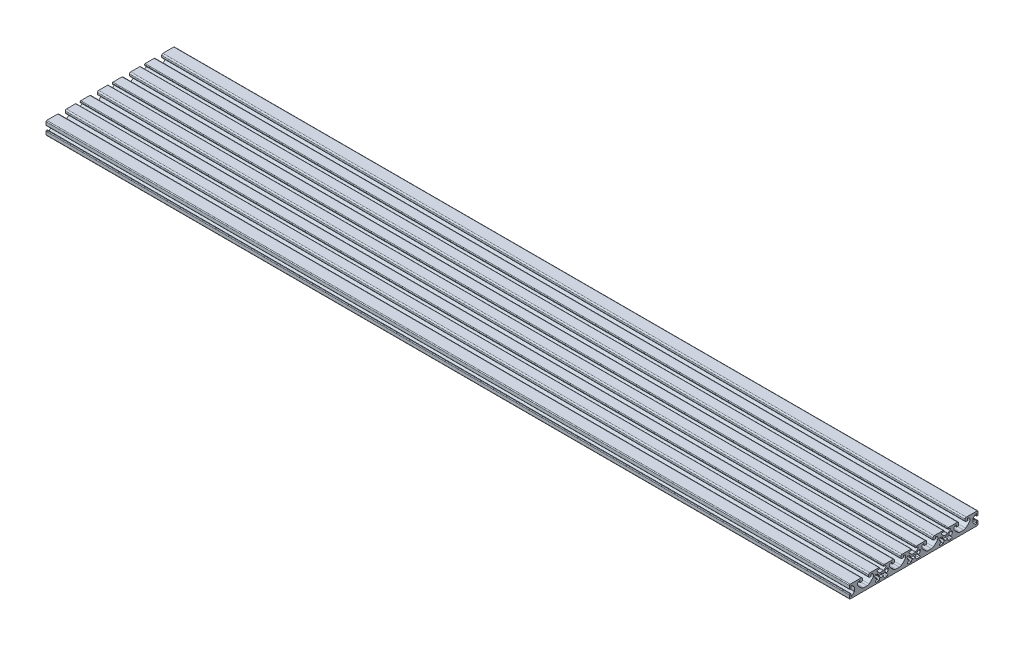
SolidWorks part; units mm, degrees
ref_plane "Ebene vorne" through (0, 0, 0) normal (0, 0, 1) x (1, 0, 0)
ref_plane "Ebene oben" through (0, 0, 0) normal (0, 1, 0) x (1, 0, 0)
ref_plane "Ebene rechts" through (0, 0, 0) normal (1, 0, 0) x (0, 0, -1)
sketch "Skizze1" plane through (0, 0, 0) normal (0, 1, 0) x (1, 0, 0)
  line L0 (0, 0) -> (1000, 0)
  dimension "D1" = 1000
other "Strukturbauteil1"
ref_plane "Ebene1" through (0, 0, 0) normal (1, 0, 0) x (0, 0, -1)
sketch "Model" plane through (0, 0, 0) normal (1, 0, 0) x (0, 0, -1)
  line L0 (-48.4749, 1.0607) -> (-47.9319, 0.5176)
  line L1 (-46, -2) -> (-46, -3)
  line L2 (-46, -3) -> (-47.4929, -4.4929)
  line L3 (-46.7858, -6.2) -> (-43, -6.2)
  line L4 (-43, -6.2) -> (-42.1979, -3.2065)
  line L5 (-37.8021, -3.2065) -> (-37, -6.2)
  line L6 (-37, -6.2) -> (-33.2142, -6.2)
  line L7 (-32.5071, -4.4929) -> (-34, -3)
  line L8 (-34, -3) -> (-34, -2)
  line L9 (-32.0681, 0.5176) -> (-31.5251, 1.0607)
  line L10 (-31.5251, 1.3435) -> (-32.6565, 2.4749)
  line L11 (-32.9393, 2.4749) -> (-33.4824, 1.9319)
  line L12 (-35.9319, -0.5176) -> (-36.4142, -1)
  line L13 (-36.4142, -1) -> (-38.2679, -1)
  line L14 (-41.7321, -1) -> (-43.5858, -1)
  line L15 (-43.5858, -1) -> (-44.0681, -0.5176)
  line L16 (-46.5176, 1.9319) -> (-47.0607, 2.4749)
  line L17 (-47.3435, 2.4749) -> (-48.4749, 1.3435)
  line L18 (50, 2.7204) -> (50, 3.5)
  line L19 (53, 5.5) -> (53, 4)
  line L20 (53.5, 3.5) -> (55, 3.5)
  line L21 (56, 4.5) -> (56, 6.5)
  line L22 (54.5, 8) -> (43.3, 8)
  line L23 (42.5, 7.2) -> (42.5, 6.5)
  line L24 (42.8, 6.2) -> (44.95, 6.2)
  line L25 (45.5157, 4.8343) -> (42.7157, 2.0343)
  line L26 (42.15, 1.8) -> (37.85, 1.8)
  line L27 (37.2843, 2.0343) -> (34.4843, 4.8343)
  line L28 (35.05, 6.2) -> (37.2, 6.2)
  line L29 (37.5, 6.5) -> (37.5, 7.2)
  line L30 (36.7, 8) -> (25.5, 8)
  line L31 (24, 6.5) -> (24, 4.5)
  line L32 (25, 3.5) -> (26.5, 3.5)
  line L33 (27, 4) -> (27, 5.5)
  line L34 (30, 3.5) -> (30, 2.7204)
  line L35 (22.1931, -4.25) -> (20, -4.25)
  line L36 (20, -4.25) -> (17.8069, -4.25)
  line L37 (10, 2.7204) -> (10, 3.5)
  line L38 (13, 5.5) -> (13, 4)
  line L39 (13.5, 3.5) -> (15, 3.5)
  line L40 (16, 4.5) -> (16, 6.5)
  line L41 (14.5, 8) -> (3.3, 8)
  line L42 (2.5, 7.2) -> (2.5, 6.5)
  line L43 (2.8, 6.2) -> (4.95, 6.2)
  line L44 (5.5157, 4.8343) -> (2.7157, 2.0343)
  line L45 (2.15, 1.8) -> (-2.15, 1.8)
  line L46 (-2.7157, 2.0343) -> (-5.5157, 4.8343)
  line L47 (-4.95, 6.2) -> (-2.8, 6.2)
  line L48 (-2.5, 6.5) -> (-2.5, 7.2)
  line L49 (-3.3, 8) -> (-14.5, 8)
  line L50 (-16, 6.5) -> (-16, 4.5)
  line L51 (-15, 3.5) -> (-13.5, 3.5)
  line L52 (-13, 4) -> (-13, 5.5)
  line L53 (-10, 3.5) -> (-10, 2.7204)
  line L54 (-17.8069, -4.25) -> (-20, -4.25)
  line L55 (-20, -4.25) -> (-22.1931, -4.25)
  line L56 (-30, 2.7204) -> (-30, 3.5)
  line L57 (-27, 5.5) -> (-27, 4)
  line L58 (-26.5, 3.5) -> (-25, 3.5)
  line L59 (-24, 4.5) -> (-24, 6.5)
  line L60 (-25.5, 8) -> (-36.7, 8)
  line L61 (-37.5, 7.2) -> (-37.5, 6.5)
  line L62 (-37.2, 6.2) -> (-35.05, 6.2)
  line L63 (-34.4843, 4.8343) -> (-37.2843, 2.0343)
  line L64 (-37.85, 1.8) -> (-42.15, 1.8)
  line L65 (-42.7157, 2.0343) -> (-45.5157, 4.8343)
  line L66 (-44.95, 6.2) -> (-42.8, 6.2)
  line L67 (-42.5, 6.5) -> (-42.5, 7.2)
  line L68 (-43.3, 8) -> (-54.5, 8)
  line L69 (-56, 6.5) -> (-56, 4.5)
  line L70 (-55, 3.5) -> (-53.5, 3.5)
  line L71 (-53, 4) -> (-53, 5.5)
  line L72 (-50, 3.5) -> (-50, 2.7204)
  line L73 (-57.8069, -4.25) -> (-60, -4.25)
  line L74 (-60, -4.25) -> (-62.1931, -4.25)
  line L75 (-70, 2.7204) -> (-70, 3.5)
  line L76 (-67, 5.5) -> (-67, 4)
  line L77 (-66.5, 3.5) -> (-65, 3.5)
  line L78 (-64, 4.5) -> (-64, 6.5)
  line L79 (-65.5, 8) -> (-79, 8)
  line L80 (-80, 7) -> (-80, 3.3)
  line L81 (-79.2, 2.5) -> (-78.5, 2.5)
  line L82 (-78.2, 2.8) -> (-78.2, 4.95)
  line L83 (-76.8343, 5.5157) -> (-74.0343, 2.7157)
  line L84 (-73.8, 2.15) -> (-73.8, -2.15)
  line L85 (-74.0343, -2.7157) -> (-76.8343, -5.5157)
  line L86 (-78.2, -4.95) -> (-78.2, -2.8)
  line L87 (-78.5, -2.5) -> (-79.2, -2.5)
  line L88 (-80, -3.3) -> (-80, -7)
  line L89 (-79, -8) -> (79, -8)
  line L90 (80, -7) -> (80, -3.3)
  line L91 (79.2, -2.5) -> (78.5, -2.5)
  line L92 (78.2, -2.8) -> (78.2, -4.95)
  line L93 (76.8343, -5.5157) -> (74.0343, -2.7157)
  line L94 (73.8, -2.15) -> (73.8, 2.15)
  line L95 (74.0343, 2.7157) -> (76.8343, 5.5157)
  line L96 (78.2, 4.95) -> (78.2, 2.8)
  line L97 (78.5, 2.5) -> (79.2, 2.5)
  line L98 (80, 3.3) -> (80, 7)
  line L99 (79, 8) -> (65.5, 8)
  line L100 (64, 6.5) -> (64, 4.5)
  line L101 (65, 3.5) -> (66.5, 3.5)
  line L102 (67, 4) -> (67, 5.5)
  line L103 (70, 3.5) -> (70, 2.7204)
  line L104 (62.1931, -4.25) -> (60, -4.25)
  line L105 (60, -4.25) -> (57.8069, -4.25)
  line L106 (-6, -2) -> (-6, -3)
  line L107 (-6, -3) -> (-7.4929, -4.4929)
  line L108 (-6.7858, -6.2) -> (-3, -6.2)
  line L109 (-3, -6.2) -> (-2.1979, -3.2065)
  line L110 (2.1979, -3.2065) -> (3, -6.2)
  line L111 (3, -6.2) -> (6.7858, -6.2)
  line L112 (7.4929, -4.4929) -> (6, -3)
  line L113 (6, -3) -> (6, -2)
  line L114 (7.9319, 0.5176) -> (8.4749, 1.0607)
  line L115 (8.4749, 1.3435) -> (7.3435, 2.4749)
  line L116 (7.0607, 2.4749) -> (6.5176, 1.9319)
  line L117 (4.0681, -0.5176) -> (3.5858, -1)
  line L118 (3.5858, -1) -> (1.7321, -1)
  line L119 (-1.7321, -1) -> (-3.5858, -1)
  line L120 (-3.5858, -1) -> (-4.0681, -0.5176)
  line L121 (-6.5176, 1.9319) -> (-7.0607, 2.4749)
  line L122 (-7.3435, 2.4749) -> (-8.4749, 1.3435)
  line L123 (-8.4749, 1.0607) -> (-7.9319, 0.5176)
  line L124 (34, -2) -> (34, -3)
  line L125 (34, -3) -> (32.5071, -4.4929)
  line L126 (33.2142, -6.2) -> (37, -6.2)
  line L127 (37, -6.2) -> (37.8021, -3.2065)
  line L128 (42.1979, -3.2065) -> (43, -6.2)
  line L129 (43, -6.2) -> (46.7858, -6.2)
  line L130 (47.4929, -4.4929) -> (46, -3)
  line L131 (46, -3) -> (46, -2)
  line L132 (47.9319, 0.5176) -> (48.4749, 1.0607)
  line L133 (48.4749, 1.3435) -> (47.3435, 2.4749)
  line L134 (47.0607, 2.4749) -> (46.5176, 1.9319)
  line L135 (44.0681, -0.5176) -> (43.5858, -1)
  line L136 (43.5858, -1) -> (41.7321, -1)
  line L137 (38.2679, -1) -> (36.4142, -1)
  line L138 (36.4142, -1) -> (35.9319, -0.5176)
  line L139 (33.4824, 1.9319) -> (32.9393, 2.4749)
  line L140 (32.6565, 2.4749) -> (31.5251, 1.3435)
  line L141 (31.5251, 1.0607) -> (32.0681, 0.5176)
  line L143 (-80, 8) -> (80, 8) construction
  line L144 (-80, 8) -> (-80, -8) construction
  line L145 (-80, -8) -> (80, -8) construction
  line L146 (80, 8) -> (80, -8) construction
  line L147 (-80, 8) -> (80, -8) construction
  line L148 (-80, -8) -> (80, 8) construction
  arc A0 (-47.9319, 0.5176) -> (-46, -2) centre (-46, 0) ccw
  arc A1 (-47.4929, -4.4929) -> (-46.7858, -6.2) centre (-46.7858, -5.2) ccw
  arc A2 (-41.6592, -3.1167) -> (-42.1979, -3.2065) centre (-41.9081, -3.2842) ccw
  arc A3 (-41.6592, -3.1167) -> (-38.3408, -3.1167) centre (-40, -2) ccw
  arc A4 (-37.8021, -3.2065) -> (-38.3408, -3.1167) centre (-38.0919, -3.2842) ccw
  arc A5 (-33.2142, -6.2) -> (-32.5071, -4.4929) centre (-33.2142, -5.2) ccw
  arc A6 (-34, -2) -> (-32.0681, 0.5176) centre (-34, 0) ccw
  arc A7 (-31.5251, 1.0607) -> (-31.5251, 1.3435) centre (-31.6665, 1.2021) ccw
  arc A8 (-32.6565, 2.4749) -> (-32.9393, 2.4749) centre (-32.7979, 2.3335) ccw
  arc A9 (-33.4824, 1.9319) -> (-35.9319, -0.5176) centre (-34, 0) ccw
  arc A10 (-38.2679, -1) -> (-41.7321, -1) centre (-40, -2) ccw
  arc A11 (-44.0681, -0.5176) -> (-46.5176, 1.9319) centre (-46, 0) ccw
  arc A12 (-47.0607, 2.4749) -> (-47.3435, 2.4749) centre (-47.2021, 2.3335) ccw
  arc A13 (-48.4749, 1.3435) -> (-48.4749, 1.0607) centre (-48.3335, 1.2021) ccw
  arc A14 (50.4052, 1.5134) -> (55.4197, -3.4595) centre (70.34, 16.6) ccw
  arc A15 (50, 2.7204) -> (50.4052, 1.5134) centre (52, 2.7204) ccw
  arc A16 (52.5, 6) -> (50, 3.5) centre (52.5, 3.5) ccw
  arc A17 (53, 5.5) -> (52.5, 6) centre (52.5, 5.5) ccw
  arc A18 (53, 4) -> (53.5, 3.5) centre (53.5, 4) ccw
  arc A19 (55, 3.5) -> (56, 4.5) centre (55, 4.5) ccw
  arc A20 (56, 6.5) -> (54.5, 8) centre (54.5, 6.5) ccw
  arc A21 (43.3, 8) -> (42.5, 7.2) centre (43.3, 7.2) ccw
  arc A22 (42.5, 6.5) -> (42.8, 6.2) centre (42.8, 6.5) ccw
  arc A23 (45.5157, 4.8343) -> (44.95, 6.2) centre (44.95, 5.4) ccw
  arc A24 (42.15, 1.8) -> (42.7157, 2.0343) centre (42.15, 2.6) ccw
  arc A25 (37.2843, 2.0343) -> (37.85, 1.8) centre (37.85, 2.6) ccw
  arc A26 (35.05, 6.2) -> (34.4843, 4.8343) centre (35.05, 5.4) ccw
  arc A27 (37.2, 6.2) -> (37.5, 6.5) centre (37.2, 6.5) ccw
  arc A28 (37.5, 7.2) -> (36.7, 8) centre (36.7, 7.2) ccw
  arc A29 (25.5, 8) -> (24, 6.5) centre (25.5, 6.5) ccw
  arc A30 (24, 4.5) -> (25, 3.5) centre (25, 4.5) ccw
  arc A31 (26.5, 3.5) -> (27, 4) centre (26.5, 4) ccw
  arc A32 (27.5, 6) -> (27, 5.5) centre (27.5, 5.5) ccw
  arc A33 (30, 3.5) -> (27.5, 6) centre (27.5, 3.5) ccw
  arc A34 (29.5948, 1.5134) -> (30, 2.7204) centre (28, 2.7204) ccw
  arc A35 (24.5803, -3.4595) -> (29.5948, 1.5134) centre (9.66, 16.6) ccw
  arc A36 (22.1931, -4.25) -> (24.5803, -3.4595) centre (22.1931, -0.25) ccw
  arc A37 (15.4197, -3.4595) -> (17.8069, -4.25) centre (17.8069, -0.25) ccw
  arc A38 (10.4052, 1.5134) -> (15.4197, -3.4595) centre (30.34, 16.6) ccw
  arc A39 (10, 2.7204) -> (10.4052, 1.5134) centre (12, 2.7204) ccw
  arc A40 (12.5, 6) -> (10, 3.5) centre (12.5, 3.5) ccw
  arc A41 (13, 5.5) -> (12.5, 6) centre (12.5, 5.5) ccw
  arc A42 (13, 4) -> (13.5, 3.5) centre (13.5, 4) ccw
  arc A43 (15, 3.5) -> (16, 4.5) centre (15, 4.5) ccw
  arc A44 (16, 6.5) -> (14.5, 8) centre (14.5, 6.5) ccw
  arc A45 (3.3, 8) -> (2.5, 7.2) centre (3.3, 7.2) ccw
  arc A46 (2.5, 6.5) -> (2.8, 6.2) centre (2.8, 6.5) ccw
  arc A47 (5.5157, 4.8343) -> (4.95, 6.2) centre (4.95, 5.4) ccw
  arc A48 (2.15, 1.8) -> (2.7157, 2.0343) centre (2.15, 2.6) ccw
  arc A49 (-2.7157, 2.0343) -> (-2.15, 1.8) centre (-2.15, 2.6) ccw
  arc A50 (-4.95, 6.2) -> (-5.5157, 4.8343) centre (-4.95, 5.4) ccw
  arc A51 (-2.8, 6.2) -> (-2.5, 6.5) centre (-2.8, 6.5) ccw
  arc A52 (-2.5, 7.2) -> (-3.3, 8) centre (-3.3, 7.2) ccw
  arc A53 (-14.5, 8) -> (-16, 6.5) centre (-14.5, 6.5) ccw
  arc A54 (-16, 4.5) -> (-15, 3.5) centre (-15, 4.5) ccw
  arc A55 (-13.5, 3.5) -> (-13, 4) centre (-13.5, 4) ccw
  arc A56 (-12.5, 6) -> (-13, 5.5) centre (-12.5, 5.5) ccw
  arc A57 (-10, 3.5) -> (-12.5, 6) centre (-12.5, 3.5) ccw
  arc A58 (-10.4052, 1.5134) -> (-10, 2.7204) centre (-12, 2.7204) ccw
  arc A59 (-15.4197, -3.4595) -> (-10.4052, 1.5134) centre (-30.34, 16.6) ccw
  arc A60 (-17.8069, -4.25) -> (-15.4197, -3.4595) centre (-17.8069, -0.25) ccw
  arc A61 (-24.5803, -3.4595) -> (-22.1931, -4.25) centre (-22.1931, -0.25) ccw
  arc A62 (-29.5948, 1.5134) -> (-24.5803, -3.4595) centre (-9.66, 16.6) ccw
  arc A63 (-30, 2.7204) -> (-29.5948, 1.5134) centre (-28, 2.7204) ccw
  arc A64 (-27.5, 6) -> (-30, 3.5) centre (-27.5, 3.5) ccw
  arc A65 (-27, 5.5) -> (-27.5, 6) centre (-27.5, 5.5) ccw
  arc A66 (-27, 4) -> (-26.5, 3.5) centre (-26.5, 4) ccw
  arc A67 (-25, 3.5) -> (-24, 4.5) centre (-25, 4.5) ccw
  arc A68 (-24, 6.5) -> (-25.5, 8) centre (-25.5, 6.5) ccw
  arc A69 (-36.7, 8) -> (-37.5, 7.2) centre (-36.7, 7.2) ccw
  arc A70 (-37.5, 6.5) -> (-37.2, 6.2) centre (-37.2, 6.5) ccw
  arc A71 (-34.4843, 4.8343) -> (-35.05, 6.2) centre (-35.05, 5.4) ccw
  arc A72 (-37.85, 1.8) -> (-37.2843, 2.0343) centre (-37.85, 2.6) ccw
  arc A73 (-42.7157, 2.0343) -> (-42.15, 1.8) centre (-42.15, 2.6) ccw
  arc A74 (-44.95, 6.2) -> (-45.5157, 4.8343) centre (-44.95, 5.4) ccw
  arc A75 (-42.8, 6.2) -> (-42.5, 6.5) centre (-42.8, 6.5) ccw
  arc A76 (-42.5, 7.2) -> (-43.3, 8) centre (-43.3, 7.2) ccw
  arc A77 (-54.5, 8) -> (-56, 6.5) centre (-54.5, 6.5) ccw
  arc A78 (-56, 4.5) -> (-55, 3.5) centre (-55, 4.5) ccw
  arc A79 (-53.5, 3.5) -> (-53, 4) centre (-53.5, 4) ccw
  arc A80 (-52.5, 6) -> (-53, 5.5) centre (-52.5, 5.5) ccw
  arc A81 (-50, 3.5) -> (-52.5, 6) centre (-52.5, 3.5) ccw
  arc A82 (-50.4052, 1.5134) -> (-50, 2.7204) centre (-52, 2.7204) ccw
  arc A83 (-55.4197, -3.4595) -> (-50.4052, 1.5134) centre (-70.34, 16.6) ccw
  arc A84 (-57.8069, -4.25) -> (-55.4197, -3.4595) centre (-57.8069, -0.25) ccw
  arc A85 (-64.5803, -3.4595) -> (-62.1931, -4.25) centre (-62.1931, -0.25) ccw
  arc A86 (-69.5948, 1.5134) -> (-64.5803, -3.4595) centre (-49.66, 16.6) ccw
  arc A87 (-70, 2.7204) -> (-69.5948, 1.5134) centre (-68, 2.7204) ccw
  arc A88 (-67.5, 6) -> (-70, 3.5) centre (-67.5, 3.5) ccw
  arc A89 (-67, 5.5) -> (-67.5, 6) centre (-67.5, 5.5) ccw
  arc A90 (-67, 4) -> (-66.5, 3.5) centre (-66.5, 4) ccw
  arc A91 (-65, 3.5) -> (-64, 4.5) centre (-65, 4.5) ccw
  arc A92 (-64, 6.5) -> (-65.5, 8) centre (-65.5, 6.5) ccw
  arc A93 (-79, 8) -> (-80, 7) centre (-79, 7) ccw
  arc A94 (-80, 3.3) -> (-79.2, 2.5) centre (-79.2, 3.3) ccw
  arc A95 (-78.5, 2.5) -> (-78.2, 2.8) centre (-78.5, 2.8) ccw
  arc A96 (-76.8343, 5.5157) -> (-78.2, 4.95) centre (-77.4, 4.95) ccw
  arc A97 (-73.8, 2.15) -> (-74.0343, 2.7157) centre (-74.6, 2.15) ccw
  arc A98 (-74.0343, -2.7157) -> (-73.8, -2.15) centre (-74.6, -2.15) ccw
  arc A99 (-78.2, -4.95) -> (-76.8343, -5.5157) centre (-77.4, -4.95) ccw
  arc A100 (-78.2, -2.8) -> (-78.5, -2.5) centre (-78.5, -2.8) ccw
  arc A101 (-79.2, -2.5) -> (-80, -3.3) centre (-79.2, -3.3) ccw
  arc A102 (-80, -7) -> (-79, -8) centre (-79, -7) ccw
  arc A103 (79, -8) -> (80, -7) centre (79, -7) ccw
  arc A104 (80, -3.3) -> (79.2, -2.5) centre (79.2, -3.3) ccw
  arc A105 (78.5, -2.5) -> (78.2, -2.8) centre (78.5, -2.8) ccw
  arc A106 (76.8343, -5.5157) -> (78.2, -4.95) centre (77.4, -4.95) ccw
  arc A107 (73.8, -2.15) -> (74.0343, -2.7157) centre (74.6, -2.15) ccw
  arc A108 (74.0343, 2.7157) -> (73.8, 2.15) centre (74.6, 2.15) ccw
  arc A109 (78.2, 4.95) -> (76.8343, 5.5157) centre (77.4, 4.95) ccw
  arc A110 (78.2, 2.8) -> (78.5, 2.5) centre (78.5, 2.8) ccw
  arc A111 (79.2, 2.5) -> (80, 3.3) centre (79.2, 3.3) ccw
  arc A112 (80, 7) -> (79, 8) centre (79, 7) ccw
  arc A113 (65.5, 8) -> (64, 6.5) centre (65.5, 6.5) ccw
  arc A114 (64, 4.5) -> (65, 3.5) centre (65, 4.5) ccw
  arc A115 (66.5, 3.5) -> (67, 4) centre (66.5, 4) ccw
  arc A116 (67.5, 6) -> (67, 5.5) centre (67.5, 5.5) ccw
  arc A117 (70, 3.5) -> (67.5, 6) centre (67.5, 3.5) ccw
  arc A118 (69.5948, 1.5134) -> (70, 2.7204) centre (68, 2.7204) ccw
  arc A119 (64.5803, -3.4595) -> (69.5948, 1.5134) centre (49.66, 16.6) ccw
  arc A120 (62.1931, -4.25) -> (64.5803, -3.4595) centre (62.1931, -0.25) ccw
  arc A121 (55.4197, -3.4595) -> (57.8069, -4.25) centre (57.8069, -0.25) ccw
  arc A122 (-7.4929, -4.4929) -> (-6.7858, -6.2) centre (-6.7858, -5.2) ccw
  arc A123 (-1.6592, -3.1167) -> (-2.1979, -3.2065) centre (-1.9081, -3.2842) ccw
  arc A124 (-1.6592, -3.1167) -> (1.6592, -3.1167) centre (0, -2) ccw
  arc A125 (2.1979, -3.2065) -> (1.6592, -3.1167) centre (1.9081, -3.2842) ccw
  arc A126 (6.7858, -6.2) -> (7.4929, -4.4929) centre (6.7858, -5.2) ccw
  arc A127 (6, -2) -> (7.9319, 0.5176) centre (6, 0) ccw
  arc A128 (8.4749, 1.0607) -> (8.4749, 1.3435) centre (8.3335, 1.2021) ccw
  arc A129 (7.3435, 2.4749) -> (7.0607, 2.4749) centre (7.2021, 2.3335) ccw
  arc A130 (6.5176, 1.9319) -> (4.0681, -0.5176) centre (6, 0) ccw
  arc A131 (1.7321, -1) -> (-1.7321, -1) centre (0, -2) ccw
  arc A132 (-4.0681, -0.5176) -> (-6.5176, 1.9319) centre (-6, 0) ccw
  arc A133 (-7.0607, 2.4749) -> (-7.3435, 2.4749) centre (-7.2021, 2.3335) ccw
  arc A134 (-8.4749, 1.3435) -> (-8.4749, 1.0607) centre (-8.3335, 1.2021) ccw
  arc A135 (-7.9319, 0.5176) -> (-6, -2) centre (-6, 0) ccw
  arc A136 (32.5071, -4.4929) -> (33.2142, -6.2) centre (33.2142, -5.2) ccw
  arc A137 (38.3408, -3.1167) -> (37.8021, -3.2065) centre (38.0919, -3.2842) ccw
  arc A138 (38.3408, -3.1167) -> (41.6592, -3.1167) centre (40, -2) ccw
  arc A139 (42.1979, -3.2065) -> (41.6592, -3.1167) centre (41.9081, -3.2842) ccw
  arc A140 (46.7858, -6.2) -> (47.4929, -4.4929) centre (46.7858, -5.2) ccw
  arc A141 (46, -2) -> (47.9319, 0.5176) centre (46, 0) ccw
  arc A142 (48.4749, 1.0607) -> (48.4749, 1.3435) centre (48.3335, 1.2021) ccw
  arc A143 (47.3435, 2.4749) -> (47.0607, 2.4749) centre (47.2021, 2.3335) ccw
  arc A144 (46.5176, 1.9319) -> (44.0681, -0.5176) centre (46, 0) ccw
  arc A145 (41.7321, -1) -> (38.2679, -1) centre (40, -2) ccw
  arc A146 (35.9319, -0.5176) -> (33.4824, 1.9319) centre (34, 0) ccw
  arc A147 (32.9393, 2.4749) -> (32.6565, 2.4749) centre (32.7979, 2.3335) ccw
  arc A148 (31.5251, 1.3435) -> (31.5251, 1.0607) centre (31.6665, 1.2021) ccw
  arc A149 (32.0681, 0.5176) -> (34, -2) centre (34, 0) ccw
  point P433 (0, 0)
  point P439 (-80, 0)
  point P440 (-60, 8)
  point P441 (-20, 8)
  point P442 (0, 8)
  point P443 (20, 8)
  point P444 (40, 8)
  point P445 (60, 8)
  point P446 (80, 0)
  point P447 (0, 0)
